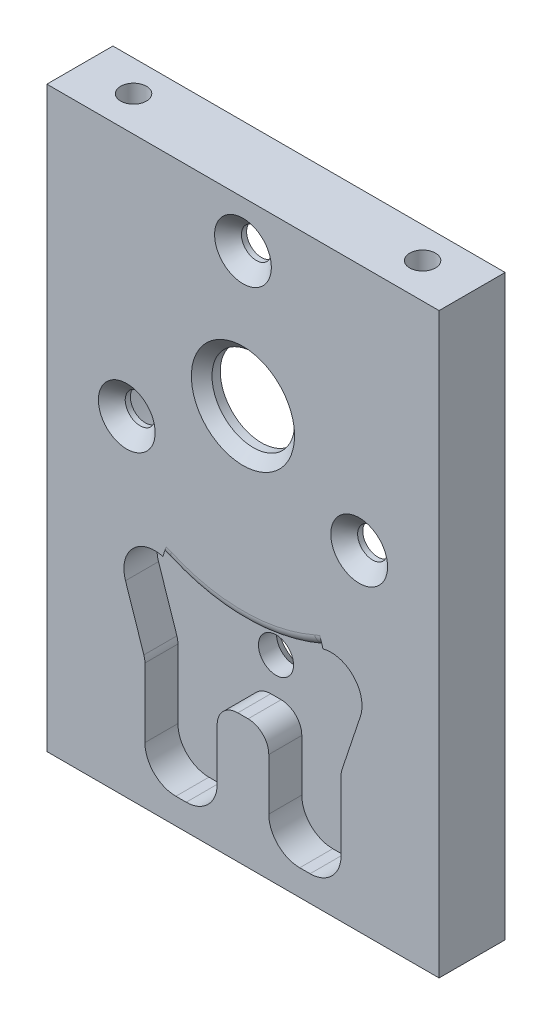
SolidWorks part; units mm, degrees
other "<Encaixe suporte>-<Filete3>"
ref_plane "Plano frontal" through (0, 0, 0) normal (0, 0, 1) x (1, 0, 0)
ref_plane "Plano superior" through (0, 0, 0) normal (0, 1, 0) x (1, 0, 0)
ref_plane "Plano direito" through (0, 0, 0) normal (1, 0, 0) x (0, 0, -1)
sketch "Esboço1" plane through (0, 0, 0) normal (0, 0, 1) x (1, 0, 0)
  line L0 (-19, 0) -> (19, 0)
  line L1 (19, 0) -> (19, 56)
  line L2 (19, 56) -> (-19, 56)
  line L4 (-19, 56) -> (-19, 0)
  circle A1 centre (0, 20) radius 4
  point P9 (-19, 0)
  dimension "D7" = 8
  dimension "D2" = 38
  dimension "D4" = 56
  dimension "D8" = 20
  dimension "D11" = 38
extrude "Ressalto-extrusão1" add sketch "Esboço1" along normal blind 6.4
sketch "Esboço6" plane through (0, 0, 0) normal (0, 0, -1) x (-1, 0, 0)
  line L1 (0, 38.5) -> (-19, 38.5) construction
  line L3 (-19, 0) -> (-19, 56) construction
  line L5 (0, 38.5) -> (0, 0) construction
  line L6 (19, 0) -> (-19, 0) construction
  circle A0 centre (0, 38.5) radius 16.54
  circle A1 centre (0, 20) radius 4 construction
  circle A2 centre (0, 20) radius 4 construction
  dimension "D1" = 33.08
  dimension "D2" = 18.5
  dimension "D3" = 19
extrude "Corte-extrusão5" cut sketch "Esboço6" against normal blind 4.6
sketch "Esboço7" plane through (0, 0, 4.6) normal (0, 0, -1) x (-1, 0, 0)
  line L0 (0, 51.5) -> (0, 38.5) construction
  line L1 (0, 38.5) -> (-11.2583, 32) construction
  circle A0 centre (0, 38.5) radius 4
  circle A1 centre (11.2583, 32) radius 1.25
  circle A2 centre (-11.2583, 32) radius 1.25
  circle A3 centre (0, 38.5) radius 16.54 construction
  circle A4 centre (0, 51.5) radius 1.25
  dimension "D1" = 8
  dimension "D2" = 2.5
  dimension "D6" = 13
  dimension "D3" = 13
  dimension "D5" = 120
  dimension "D4" = 3
extrude "Corte-extrusão6" cut sketch "Esboço7" against normal through all
hole_wizard "Escareado para parafuso de máquina com cabeça chata de M2.51" positions "Esboço9" profile "Esboço10" countersink size "M2.5" standard "Ansi Metric"
sketch "Esboço9" plane through (0, 0, 6.4) normal (0, 0, 1) x (1, 0, 0)
  point P0 (0, 51.5)
  point P1 (11.2583, 32)
  point P4 (-11.2583, 32)
sketch "Esboço10" plane through (0, 51.5, 6.4) normal (1, 0, 0) x (0, -1, 0)
  line L0 (0, 0) -> (0, 2.6702)
  line L1 (0, 2.6702) -> (1.45, 1.799)
  line L2 (1.45, 1.799) -> (1.45, 1.3)
  line L3 (1.45, 1.3) -> (2.75, 0)
  line L5 (2.75, 0) -> (0, 0)
  line L6 (-1.45, 1.3) -> (-2.75, 0) construction
  line L10 (0, 2.6702) -> (-1.45, 1.799) construction
  line L11 (0, -6.35) -> (0, 107.95) construction
  dimension "Hole Dia." = 2.9
  dimension "Hole Depth" = 1.799
  dimension "Near C'Sink Dia." = 5.5
  dimension "Near C'Sink Angle" = 90
  dimension "Drill Angle" = 118
sketch "Esboço15" plane through (0, 0, 0) normal (0, 0, -1) x (-1, 0, 0)
  arc A0 (-3.2806, 22.2886) -> (3.2806, 22.2886) centre (0, 20) ccw construction
  arc A1 (-3.2806, 22.2886) -> (3.2806, 22.2886) centre (0, 20) ccw
  arc A2 (-3.2806, 22.2886) -> (3.2806, 22.2886) centre (0, 38.5) ccw
  circle A3 centre (0, 38.5) radius 16.54 construction
extrude "Ressalto-extrusão2" add sketch "Esboço15" against normal up to surface (4.6 mm away)
sketch "Esboço16" plane through (0, 0, 4.6) normal (0, 0, 1) x (1, 0, 0)
  arc A0 (-3.2806, 22.2886) -> (3.2806, 22.2886) centre (0, 20) ccw construction
  arc A1 (3.2806, 22.2886) -> (-3.2806, 22.2886) centre (0, 20) ccw construction
  arc A2 (-3.2806, 22.2886) -> (3.2806, 22.2886) centre (0, 20) ccw
  arc A3 (3.2806, 22.2886) -> (-3.2806, 22.2886) centre (0, 20) ccw
sketch "Esboço29" plane through (0, 0, 0) normal (0, -1, 0) x (1, 0, 0)
  line L0 (-19, 3.2) -> (19, 3.2) construction
  line L1 (-19, 6.4) -> (-19, 0) construction
  line L2 (19, 6.4) -> (19, 0) construction
  point P6 (-12, 3.2)
  point P7 (0, 3.2)
  point P8 (12, 3.2)
  dimension "D1" = 12
  dimension "D2" = 12
sketch "Esboço30" plane through (0, 56, 0) normal (0, 1, 0) x (1, 0, 0)
  line L0 (19, -3.2) -> (-19, -3.2) construction
  line L1 (19, -6.4) -> (19, 0) construction
  line L2 (-19, -6.4) -> (-19, 0) construction
  point P6 (14, -3.2)
  point P7 (-14, -3.2)
  dimension "D1" = 5
  dimension "D2" = 5
chamfer "Chanfro2" distance 1 angle 45 1 edges at (-4, 38.5, 6.4)
sketch "Sketch1" plane through (0, 56, 0) normal (0, 1, 0) x (1, 0, 0)
  line L0 (19, 0) -> (-19, 0) construction
  line L1 (-19, -6.4) -> (-19, 0) construction
  line L2 (0, 0) -> (0, -6.4) construction
  line L3 (19, -6.4) -> (-19, -6.4) construction
  circle A0 centre (-14, -3) radius 1.25
  circle A1 centre (14, -3) radius 1.25
  point P0 (-14, -3)
  point P2 (14, -3)
  dimension "D3" = 2.5
  dimension "D1" = 3
  dimension "D2" = 5
extrude "Cut-Extrude1" cut sketch "Sketch1" against normal blind 6
sketch "Sketch2" plane through (0, 0, 0) normal (0, -1, 0) x (-1, 0, 0)
  line L0 (19, 0) -> (-19, 0) construction
  line L1 (0, 0) -> (0, -6.4) construction
  line L2 (19, -6.4) -> (-19, -6.4) construction
  line L3 (-19, -6.4) -> (-19, 0) construction
  circle A0 centre (-12, -3) radius 1.25
  circle A1 centre (0, -3) radius 1.25
  circle A2 centre (12, -3) radius 1.25
  dimension "D2" = 2.5
  dimension "D3" = 7
  dimension "D1" = 3
extrude "Cut-Extrude2" cut sketch "Sketch2" against normal blind 10
sketch "Esboço36" plane through (0, 0, 6.4) normal (0, 0, 1) x (1, 0, 0)
  circle A0 centre (0, 20) radius 4 construction
  circle A1 centre (0, 20) radius 4
extrude "Ressalto-extrusão3" add sketch "Esboço36" against normal up to vertex
sketch "Esboço35" plane through (0, 0, 0) normal (0, 0, -1) x (-1, 0, 0)
  line L0 (0, 20) -> (0, 16) construction
  arc A0 (-3.2806, 22.2886) -> (3.2806, 22.2886) centre (0, 20) ccw construction
  point P6 (0, 18)
ref_plane "Plano10" through (0, 20, 0) normal (0, -1, 0) x (-1, 0, 0)
ref_plane "Plano frontal-Encaixe suporte" through (56.5944, 28.2789, 17.4659) normal (0, 0, -1) x (-1, 0, 0)
ref_plane "Plano superior-Encaixe suporte" through (56.5944, 28.2789, 17.4659) normal (0, 1, 0) x (-1, 0, 0)
ref_plane "Plano direito-Encaixe suporte" through (56.5944, 28.2789, 17.4659) normal (-1, 0, 0) x (0, 0, 1)
inserted part "Encaixe suporte"
move or copy body "Corpo-Mover/Copiar5"
move or copy body "Corpo-Mover/Copiar6" bodies to move or copy 139 placed by mates yes
combine bodies "Combinar1" operation type subtract main body 135 bodies to subtract 140
hole_wizard "Escareado para parafuso de máquina com cabeça chata de M31" positions "3DSketch4" profile "Esboço40" countersink size "M3" standard "Ansi Metric"
sketch3d "3DSketch4"
  point P0 (9.7751, -5.7099, 52.8)
  point P3 (0, 0, 0)
  point P4 (9.7751, -4.6142, 52.8)
  point P5 (9.7751, -5.5174, 52.8)
  point P6 (0, 0, 0)
  point P7 (9.7751, -4.3792, 52.8)
  point P8 (9.7751, -4.2426, 52.8)
  point P9 (0, 0, 0)
  point P10 (9.7751, -5.3106, 52.8)
sketch "Esboço40" plane through (0, 16, 0) normal (1, 0, 0) x (0, 1, 0)
  line L0 (0, 0) -> (0, 9.0215)
  line L1 (0, 9.0215) -> (1.7, 8)
  line L2 (1.7, 8) -> (1.7, 1.45)
  line L3 (1.7, 1.45) -> (3.15, 0)
  line L4 (3.15, 0) -> (0, 0)
  line L5 (-1.7, 1.45) -> (-3.15, 0) construction
  line L6 (0, 9.0215) -> (-1.7, 8) construction
  line L7 (0, -6.35) -> (0, 107.95) construction
  dimension "Hole Dia." = 3.4
  dimension "Hole Depth" = 8
  dimension "Near C'Sink Dia." = 6.3
  dimension "Near C'Sink Angle" = 90
  dimension "Drill Angle" = 118
